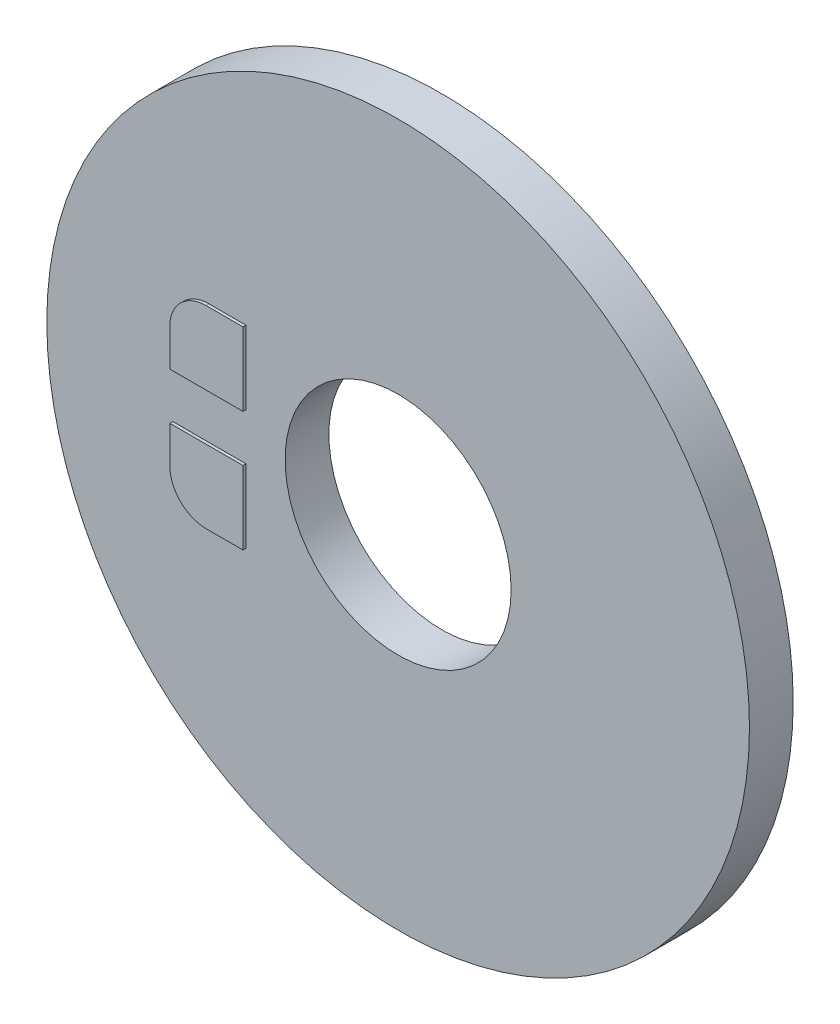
SolidWorks part; units mm, degrees
ref_plane "Front" through (0, 0, 0) normal (0, 0, 1) x (1, 0, 0)
ref_plane "Top" through (0, 0, 0) normal (0, 1, 0) x (1, 0, 0)
ref_plane "Right" through (0, 0, 0) normal (1, 0, 0) x (0, 0, -1)
sketch "Sketch1" plane through (0, 0, 0) normal (0, 0, 1) x (1, 0, 0)
  circle A2 centre (0, 0) radius 4.7625
  circle A3 centre (0, 0) radius 15.24
  dimension "D1" = 9.525
  dimension "D2" = 30.48
extrude "Extrude1" add sketch "Sketch1" along normal blind 1.8974
sketch "Sketch3" plane through (0, 0, 1.8974) normal (0, 0, 1) x (1, 0, 0)
  line L1 (-8.2042, 4.191) -> (-6.604, 4.191)
  line L2 (-9.779, 2.6162) -> (-9.779, 1.016)
  line L3 (-9.779, 1.016) -> (-6.604, 1.016)
  line L4 (-6.604, 4.191) -> (-6.604, 1.016)
  arc A0 (-9.779, 2.6162) -> (-8.2042, 4.191) centre (-8.2042, 2.6162) cw
  point P7 (-9.779, 4.191)
  dimension "D1" = 3.175
  dimension "D4" = 1.5748
  dimension "D2" = 1.016
  dimension "D3" = 6.604
extrude "Extrude3" add sketch "Sketch3" along normal blind 0.127
mirror "Mirror1" about plane through (0, 0, 0) normal (0, 1, 0) of "Extrude3"
sketch "Sketch4" plane through (0, 0, 0) normal (0, 0, 1) x (1, 0, 0)
  line L2 (15.0225, -2.5654) -> (17.272, -2.5654)
  line L5 (15.0225, -2.5654) -> (15.0225, 2.5654)
  line L6 (15.0225, 2.5654) -> (17.272, 2.5654)
  circle A0 centre (0, 0) radius 15.24 construction
  arc A2 (17.272, -2.5654) -> (17.272, 2.5654) centre (17.272, 0) ccw
  point P12 (15.0225, 0)
  dimension "D2" = 5.1308
  dimension "D3" = 2.5654
  dimension "D1" = 17.272
extrude "Extrude4" add sketch "Sketch4" along normal up to surface (1.8974 mm away)
hole_wizard "CSK for #2 Flat Head Machine Screw (100)1" positions "Sketch6" profile "Sketch5" countersink size "#2" standard "Ansi Inch"
sketch "Sketch6" plane through (0, 0, 0) normal (0, 0, -1) x (-1, 0, 0)
  arc A1 (-17.272, 2.5654) -> (-17.272, -2.5654) centre (-17.272, 0) ccw construction
  point P0 (-17.272, 0)
sketch "Sketch5" plane through (17.272, 0, 0) normal (1, 0, 0) x (0, 1, 0)
  line L0 (0, 0) -> (0, 133.1696)
  line L1 (0, 133.1696) -> (1.2192, 132.437)
  line L2 (1.2192, 132.437) -> (1.2192, 1.3733)
  line L3 (1.2192, 1.3733) -> (2.413, 0)
  line L5 (2.413, 0) -> (0, 0)
  line L6 (-1.2192, 1.3733) -> (-2.413, 0) construction
  line L10 (0, 133.1696) -> (-1.2192, 132.437) construction
  line L11 (0, -6.35) -> (0, 107.95) construction
  dimension "Hole Dia." = 2.4384
  dimension "Hole Depth" = 132.437
  dimension "Near C'Sink Dia." = 4.826
  dimension "Near C'Sink Angle" = 82
  dimension "Drill Angle" = 118
pattern_circular "CirPattern1" count 3 over 360 about axis through (0, 0, 0) along (0, 0, 1) of "Extrude4", "CSK for #2 Flat Head Machine Screw (100)1"
sketch "Sketch8" [suppressed] plane through (0, 0, 0) normal (0, 0, 1) x (1, 0, 0)
  circle A0 centre (0, 0) radius 19.8374 construction
  arc A2 (-6.4143, 16.2407) -> (-10.8577, 13.6753) centre (-8.636, 14.958) ccw construction
  dimension "D1" = 39.6748
fillet "Fillet2" [suppressed] radius 0.762
sketch "Sketch9" plane through (0, 0, 1.8974) normal (0, 0, 1) x (1, 0, 0)
  circle A0 centre (0, 0) radius 4.9022
  circle A1 centre (0, 0) radius 15.24
  dimension "D1" = 9.8044
  dimension "D2" = 30.48
extrude "Cut-Extrude1" cut sketch "Sketch9" against normal blind 2.54 and the other way blind 10 flip side to cut
sketch "Sketch10" plane through (0, 0, 2.0244) normal (0, 0, 1) x (1, 0, 0)
  line L0 (0, 0) -> (-14.7476, -3.8428) construction
  line L1 (-9.9915, -1.016) -> (-9.9915, -4.191) construction
  line L2 (-9.779, -1.016) -> (-6.604, -1.016) construction
  line L3 (-6.604, -4.191) -> (-8.2042, -4.191) construction
  circle A0 centre (-9.9915, -2.6035) radius 0.8509
  circle A1 centre (0, 0) radius 15.24 construction
  point P8 (-10.8149, -2.8181)
  dimension "D1" = 1.7018
  dimension "D2" = 4.064
extrude "Extrude5" [suppressed] add sketch "Sketch10" along normal blind 2.54
mirror "Mirror2" [suppressed] about plane through (0, 0, 0) normal (0, 1, 0)
fillet "Fillet3" [suppressed] radius 1.016
